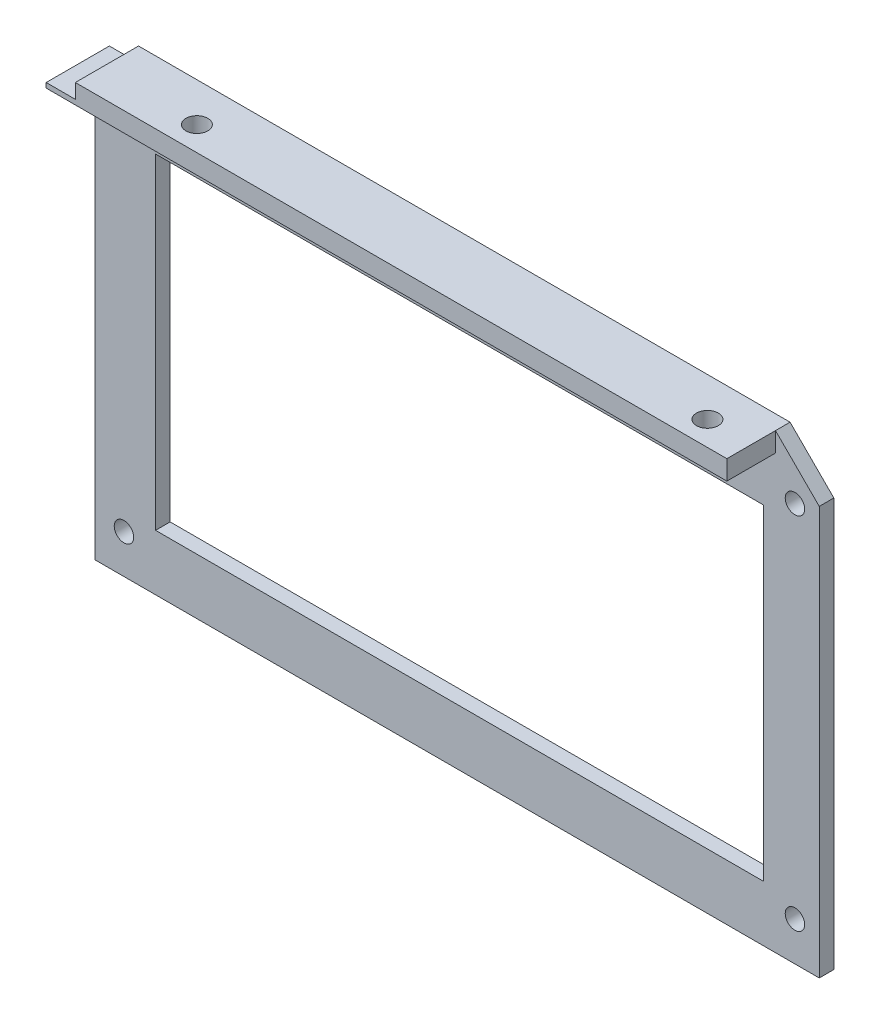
SolidWorks part; units mm, degrees
ref_plane "Front Plane" through (0, 0, 0) normal (0, 0, 1) x (1, 0, 0)
ref_plane "Top Plane" through (0, 0, 0) normal (0, 1, 0) x (1, 0, 0)
ref_plane "Right Plane" through (0, 0, 0) normal (1, 0, 0) x (0, 0, -1)
sketch "Sketch1" plane through (0, 0, 0) normal (0, 1, 0) x (1, 0, 0)
  line L0 (70, -1.5) -> (-70, -1.5) construction
  line L1 (-70, 6.5) -> (70, 6.5)
  line L2 (-70, 6.5) -> (-70, -6.5)
  line L3 (-70, -6.5) -> (70, -6.5)
  line L4 (70, 6.5) -> (70, -6.5)
  line L5 (-70, 6.5) -> (70, -6.5) construction
  line L6 (-70, -6.5) -> (70, 6.5) construction
  circle A0 centre (61, -1.5) radius 2.25
  circle A1 centre (-44, -1.5) radius 2.25
  point P0 (0, 0)
  dimension "D4" = 105
  dimension "D5" = 4.5
  dimension "D1" = 140
  dimension "D2" = 13
  dimension "D3" = 5
  dimension "D6" = 9
extrude "Boss-Extrude1" add sketch "Sketch1" against normal blind 4
sketch "Sketch2" plane through (0, 0, -6.5) normal (0, 0, -1) x (-1, 0, 0)
  line L1 (-70, 0) -> (70, 0)
  line L2 (-70, 0) -> (-70, -93)
  line L3 (-70, -93) -> (70, -93)
  line L4 (70, 0) -> (70, -93)
  line L5 (-70, -93) -> (-79, -93)
  line L6 (-70, -93) -> (-70, 0)
  line L7 (-70, 0) -> (-79, -9)
  line L8 (-79, -93) -> (-79, -9)
  point P4 (0, 0)
  point P10 (-71, -15.5243)
  point P11 (-71, -15.2368)
  point P12 (-81, -16.0414)
  point P13 (-71, -9.8967)
  point P14 (-71, -3)
  point P16 (0, 0)
  point P17 (-70, -4.0358)
  point P18 (-70, -2.3615)
  point P19 (0, 0)
  point P20 (-70, -0.3701)
  dimension "D1" = 93
  dimension "D2" = 45
  dimension "D3" = 9
extrude "Boss-Extrude2" add sketch "Sketch2" against normal blind 3 contours L4 L2 L3 M7 | L8 L5 L2 L7
sketch "Sketch3" plane through (0, 0, -6.5) normal (0, 0, -1) x (-1, 0, 0)
  line L0 (-74, -11) -> (64, -11) construction
  line L1 (64, -11) -> (64, -85) construction
  line L2 (64, -85) -> (-74, -85) construction
  line L3 (-74, -85) -> (-74, -11) construction
  line L4 (44, 0) -> (44, -95) construction
  line L5 (-70, 0) -> (70, 0) construction
  line L8 (41.75, -4) -> (46.25, -4) construction
  line L9 (41.75, -4) -> (46.25, -4)
  line L10 (64, -11) -> (-74, -85) construction
  line L11 (64, -85) -> (-74, -11) construction
  line L13 (57.5, -14.4855) -> (-67.5, -14.4855)
  line L14 (57.5, -14.4855) -> (57.5, -81.5145)
  line L15 (57.5, -81.5145) -> (-67.5, -81.5145)
  line L16 (-67.5, -14.4855) -> (-67.5, -81.5145)
  line L17 (57.5, -14.4855) -> (-67.5, -81.5145) construction
  line L18 (57.5, -81.5145) -> (-67.5, -14.4855) construction
  circle A0 centre (64, -11) radius 2
  circle A1 centre (64, -85) radius 2
  circle A2 centre (-74, -11) radius 2
  circle A3 centre (-74, -85) radius 2
  point P8 (-5, -48)
  point P13 (-5, -48)
  point P14 (44, -4)
  dimension "D1" = 4
  dimension "D2" = 138
  dimension "D3" = 74
  dimension "D4" = 125
  dimension "D5" = 11
  dimension "D6" = 20
extrude "Cut-Extrude1" cut sketch "Sketch3" against normal blind 3 contours L13 L16 L15 L14 | A0 | A2 | A3 | A1
ref_plane "Plane1" through (3.5, 0, 0) normal (-1, 0, 0) x (0, 0, 1)
sketch "Sketch4" plane through (3.5, 0, 0) normal (-1, 0, 0) x (0, 0, 1)
  line L0 (-3.5, -4) -> (-3.5, -8)
  line L1 (-3.5, -4) -> (-3.5, -93) construction
  line L2 (-3.5, -8) -> (0.5, -4)
  line L3 (-3.5, -4) -> (6.5, -4) construction
  line L4 (0.5, -4) -> (-3.5, -4)
  dimension "D1" = 4
extrude "Boss-Extrude3" add sketch "Sketch4" along normal mid plane 80
sketch "Sketch6" plane through (0, 0, -6.5) normal (0, 0, -1) x (-1, 0, 0)
  line L1 (70, 0) -> (64, 0)
  line L2 (70, 0) -> (70, -3)
  line L3 (70, -3) -> (64, -3)
  line L4 (64, 0) -> (64, -3)
  dimension "D1" = 6
  dimension "D2" = 3
extrude "Cut-Extrude2" cut sketch "Sketch6" against normal up to next
sketch "Sketch8" plane through (0, 0, -3.5) normal (0, 0, 1) x (1, 0, 0)
  circle A0 centre (-36.5, -8) radius 4
  circle A1 centre (43.5, -8) radius 4
  point P4 (-38.4996, -8.0187)
  point P5 (-37.5, -7)
  point P7 (42.5, -7)
  dimension "D1" = 8
extrude "Cut-Extrude4" cut sketch "Sketch8" along normal blind 6
